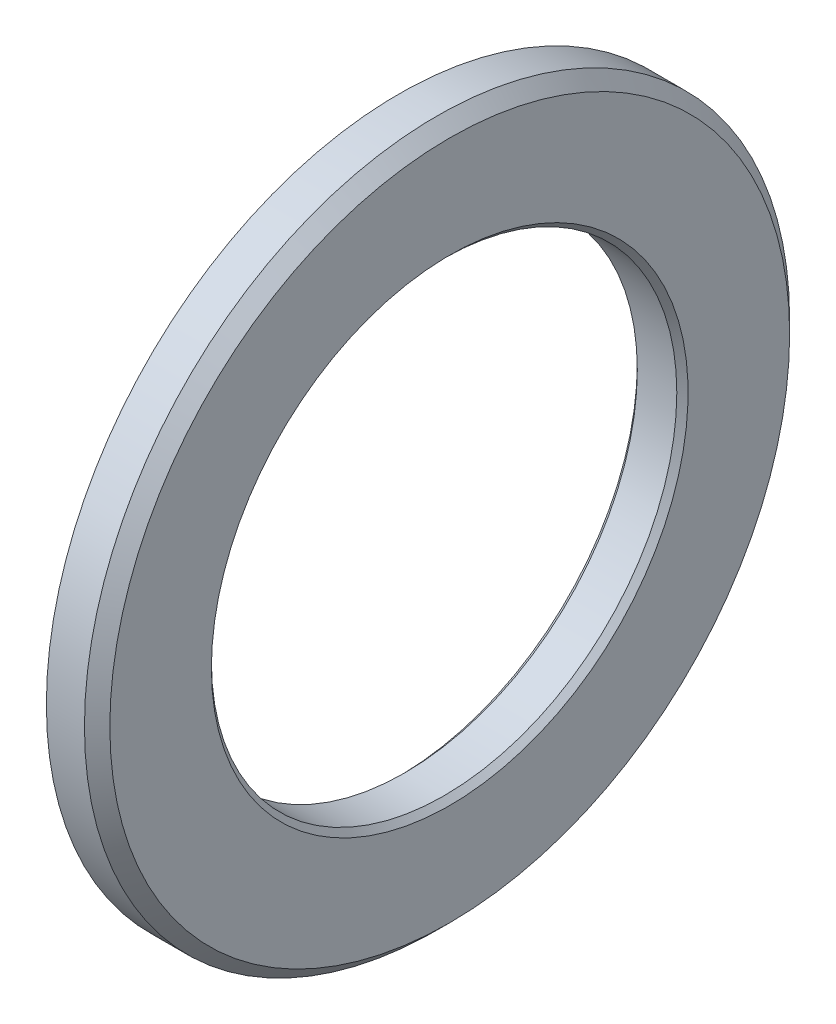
SolidWorks part; units mm, degrees
ref_plane "Plane1" through (0, 0, 0) normal (0, 0, 1) x (1, 0, 0)
ref_plane "Plane2" through (0, 0, 0) normal (0, 1, 0) x (1, 0, 0)
ref_plane "Plane3" through (0, 0, 0) normal (1, 0, 0) x (0, 0, -1)
other "Configuration Table"
sketch "Sketch1" plane through (0, 0, 0) normal (0, 0, 1) x (1, 0, 0)
  line L0 (-34.925, 0) -> (9.525, 0) construction
  line L1 (0, 82.5) -> (0, 125)
  line L2 (0, 125) -> (-18, 125)
  line L3 (-18, 125) -> (-18, 82.5)
  line L4 (-18, 82.5) -> (0, 82.5)
revolve "Base-Revolve" add sketch "Sketch1" angle 360 about L0
chamfer "IDChamfer" distance 2 angle 45 1 edges at (0, 0, 82.5)
chamfer "ODChamfer" distance 4.5 angle 45 1 edges at (0, 0, 125)
chamfer "IDChamferFar" distance 2 angle 45 1 edges at (-18, 0, 82.5)
equation "\"D1@ODChamfer\" =  \"Thickness@Sketch1\" * 0.25"
equation "\"D1@IDChamferFar\" =  \"Chamfer_width@IDChamfer\""
